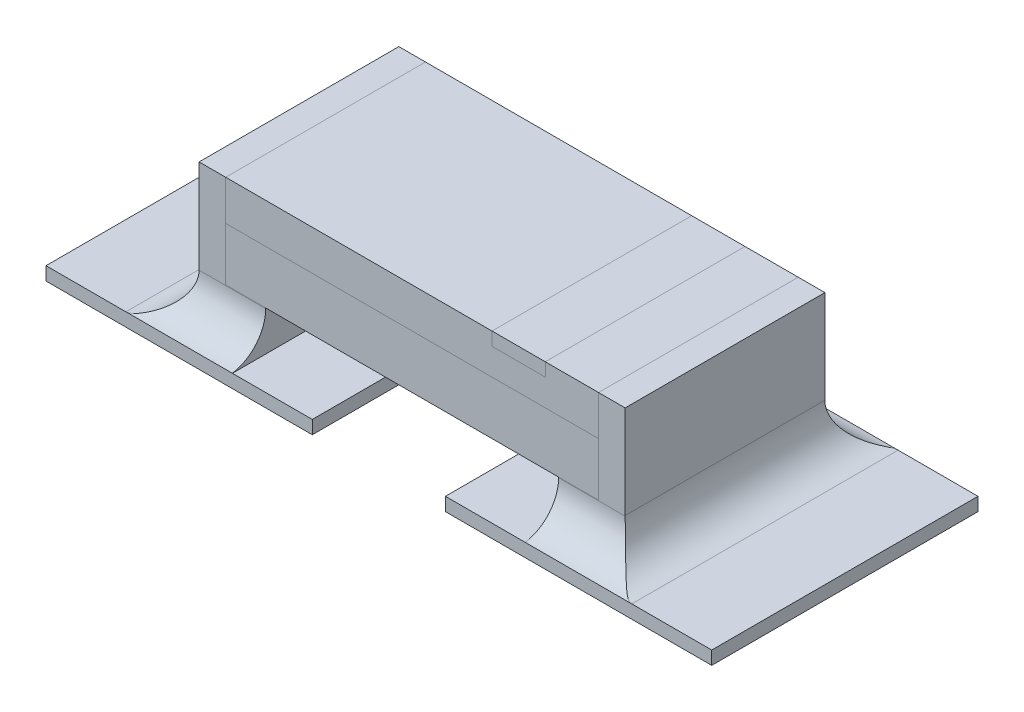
SolidWorks part; units mm, degrees
ref_plane "Plan de face" through (0, 0, 0) normal (0, 0, 1) x (1, 0, 0)
ref_plane "Plan de dessus" through (0, 0, 0) normal (0, 1, 0) x (1, 0, 0)
ref_plane "Plan de droite" through (0, 0, 0) normal (1, 0, 0) x (0, 0, -1)
sketch "Esquisse1" plane through (0, 0, 0) normal (0, 1, 0) x (1, 0, 0)
  line L0 (-0.5, 0) -> (0.5, 0) construction
  line L1 (-2.5, 1) -> (-0.5, 1)
  line L2 (-2.5, 1) -> (-2.5, -1)
  line L3 (-2.5, -1) -> (-0.5, -1)
  line L4 (-0.5, 1) -> (-0.5, -1)
  line L5 (0.5, 1) -> (2.5, 1)
  line L6 (0.5, 1) -> (0.5, -1)
  line L7 (0.5, -1) -> (2.5, -1)
  line L8 (2.5, 1) -> (2.5, -1)
  point P8 (-0.5, 0)
  point P12 (0, 0)
  dimension "D1" = 1
  dimension "D2" = 2
extrude "Boss.-Extru.1" add sketch "Esquisse1" along normal blind 0.1
sketch "Esquisse2" plane through (0, 0.1, 0) normal (0, 1, 0) x (1, 0, 0)
  line L0 (-0.5, 1) -> (-2.5, 1) construction
  line L1 (-1.6, 0.75) -> (-1.4, 0.75)
  line L2 (-1.6, 0.75) -> (-1.6, -0.75)
  line L3 (-1.6, -0.75) -> (-1.4, -0.75)
  line L4 (-1.4, 0.75) -> (-1.4, -0.75)
  line L5 (1.4, 0.75) -> (1.6, 0.75)
  line L6 (1.4, 0.75) -> (1.4, -0.75)
  line L7 (1.4, -0.75) -> (1.6, -0.75)
  line L8 (1.6, 0.75) -> (1.6, -0.75)
  line L9 (2.5, 1) -> (0.5, 1) construction
  point P8 (-1.4, 0)
  point P10 (-1.5, 1)
  point P11 (1.5, 1)
  point P14 (-1.5, 0.75)
  point P17 (1.5, 0.75)
  dimension "D1" = 0.2
  dimension "D2" = 1.5
extrude "Boss.-Extru.2" add sketch "Esquisse2" along normal blind 1
sketch "Esquisse3" plane through (0, 0.1, 0) normal (0, 1, 0) x (1, 0, 0)
  line L0 (-1.6, -0.75) -> (-1.4, -0.75) construction
  line L1 (-1.4, 0.75) -> (-1.1, 0.75)
  line L2 (-1.4, 0.75) -> (-1.4, -0.75)
  line L3 (-1.4, -0.75) -> (-1.1, -0.75)
  line L4 (-1.1, 0.75) -> (-1.1, -0.75)
  line L5 (1.4, 0.75) -> (1.1, 0.75)
  line L6 (1.4, 0.75) -> (1.4, -0.75)
  line L7 (1.4, -0.75) -> (1.1, -0.75)
  line L8 (1.1, 0.75) -> (1.1, -0.75)
  dimension "D1" = 0.3
  dimension "D2" = 0.3
extrude "Boss.-Extru.3" add sketch "Esquisse3" along normal blind 0.3
fillet "Congé1" radius 0.3 3 edges at (-1.35, 0.1, -0.75) (-1.35, 0.1, 0.75) (-1.6, 0.1, 0)
fillet "Congé2" radius 0.3 3 edges at (1.35, 0.1, -0.75) (1.6, 0.1, 0) (1.35, 0.1, 0.75)
sketch "Esquisse4" plane through (0, 0.4, 0) normal (0, 1, 0) x (1, 0, 0)
  line L1 (-1.4, 0.75) -> (1.4, 0.75)
  line L2 (-1.4, 0.75) -> (-1.4, -0.75)
  line L3 (-1.4, -0.75) -> (1.4, -0.75)
  line L4 (1.4, 0.75) -> (1.4, -0.75)
extrude "Boss.-Extru.4" add sketch "Esquisse4" along normal blind 0.4 separate body
sketch "Esquisse5" plane through (0, 0.8, 0) normal (0, 1, 0) x (1, 0, 0)
  line L1 (-1.4, 0.75) -> (1.4, 0.75)
  line L2 (-1.4, 0.75) -> (-1.4, -0.75)
  line L3 (-1.4, -0.75) -> (1.4, -0.75)
  line L4 (1.4, 0.75) -> (1.4, -0.75)
extrude "Boss.-Extru.5" add sketch "Esquisse5" along normal blind 0.3 separate body
sketch "Esquisse6" plane through (0, 1.1, 0) normal (0, 1, 0) x (1, 0, 0)
  line L0 (1.4, 0.75) -> (-1.4, 0.75) construction
  line L1 (1, 0.75) -> (0.6, 0.75)
  line L2 (1, 0.75) -> (1, -0.75)
  line L3 (1, -0.75) -> (0.6, -0.75)
  line L4 (0.6, 0.75) -> (0.6, -0.75)
  line L5 (-1.4, -0.75) -> (1.4, -0.75) construction
  line L6 (1.4, -0.75) -> (1.4, 0.75) construction
  dimension "D1" = 0.4
  dimension "D2" = 0.4
extrude "Enlèv. mat.-Extru.1" cut sketch "Esquisse6" against normal blind 0.1
sketch "Esquisse7" plane through (0, 1, 0) normal (0, 1, 0) x (1, 0, 0)
  line L1 (0.6, 0.75) -> (1, 0.75)
  line L2 (0.6, 0.75) -> (0.6, -0.75)
  line L3 (0.6, -0.75) -> (1, -0.75)
  line L4 (1, 0.75) -> (1, -0.75)
extrude "Boss.-Extru.7" add sketch "Esquisse7" along normal blind 0.1 separate body
